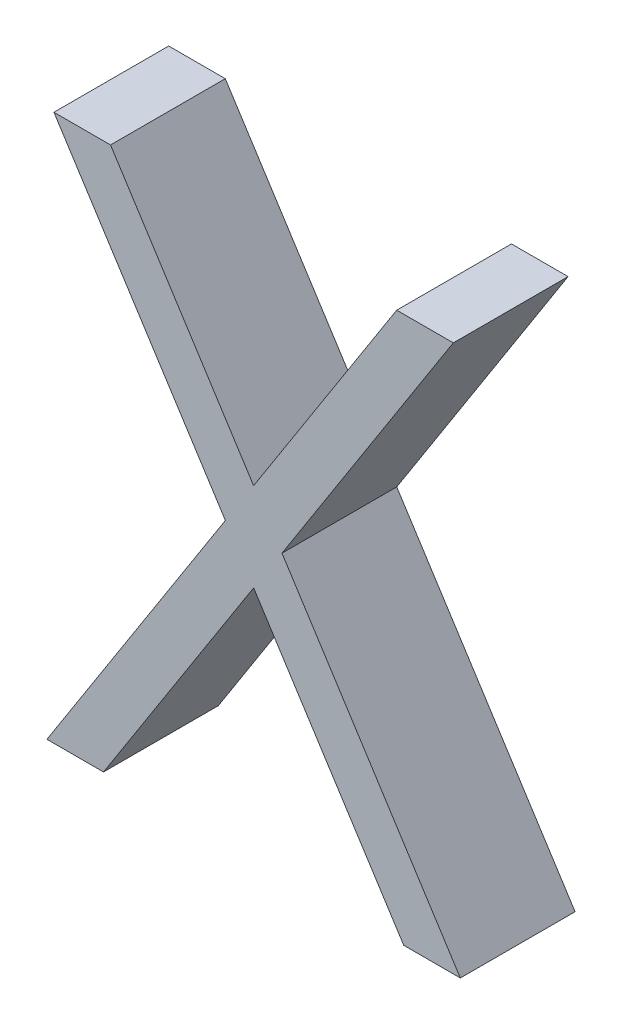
SolidWorks part; units mm, degrees
ref_plane "Face" through (0, 0, 0) normal (0, 0, 1) x (1, 0, 0)
ref_plane "Dessus" through (0, 0, 0) normal (0, 1, 0) x (1, 0, 0)
ref_plane "Droite" through (0, 0, 0) normal (1, 0, 0) x (0, 0, -1)
sketch "Esquisse1" plane through (0, 0, 0) normal (0, 0, 1) x (1, 0, 0)
  text T0 "X" font "Century Gothic" height in points 72
extrude "Boss.-Extru.1" add sketch "Esquisse1" along normal mid plane 4
